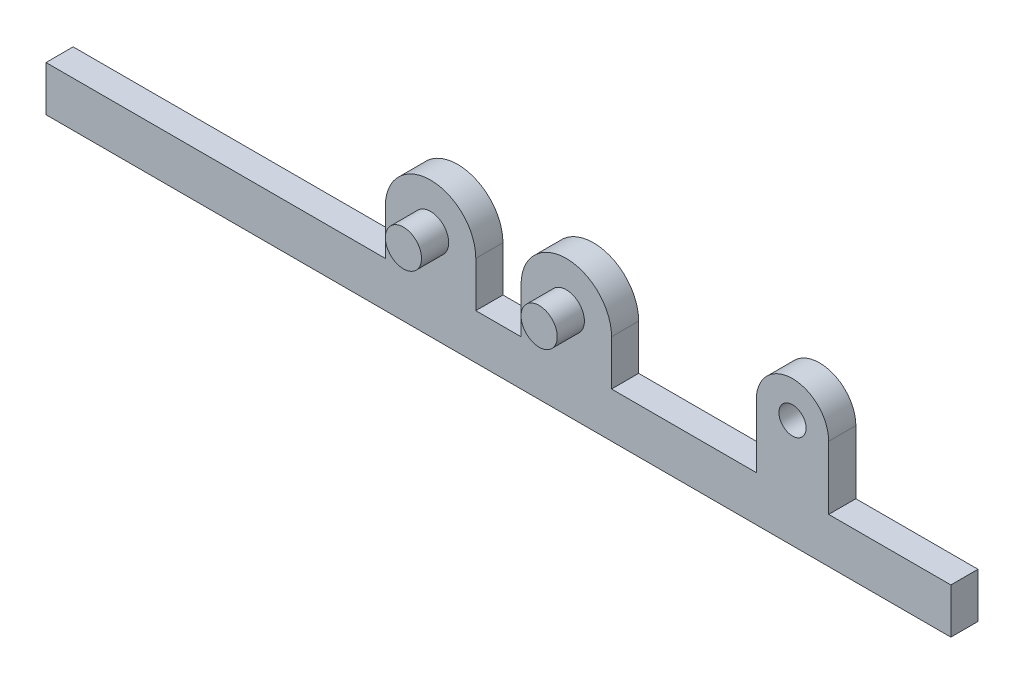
SolidWorks part; units mm, degrees
ref_plane "Face" through (0, 0, 0) normal (0, 0, 1) x (1, 0, 0)
ref_plane "Dessus" through (0, 0, 0) normal (0, 1, 0) x (1, 0, 0)
ref_plane "Droite" through (0, 0, 0) normal (1, 0, 0) x (0, 0, -1)
sketch "Esquisse1" plane through (0, 0, 0) normal (0, 0, 1) x (1, 0, 0)
  line L0 (500, 0) -> (500, -50)
  line L1 (0, 0) -> (375, 0)
  line L2 (0, 0) -> (0, -50)
  line L3 (0, -50) -> (500, -50)
  line L6 (375, 0) -> (375, 50)
  line L8 (475, 0) -> (475, 50)
  line L13 (475, 0) -> (500, 0)
  arc A0 (375, 50) -> (475, 50) centre (425, 50) cw
  dimension "D4" = 50
  dimension "D3" = 50
  dimension "D5" = 75
  dimension "D1" = 500
  dimension "D2" = 50
extrude "Extrusion1" add sketch "Esquisse1" along normal blind 30
sketch "Esquisse2" plane through (0, 0, 30) normal (0, 0, 1) x (1, 0, 0)
  circle A0 centre (425, 50) radius 20
  dimension "D1" = 40
extrude "Extrusion2" add sketch "Esquisse2" along normal blind 30
mirror "Symétrie1"
sketch "Esquisse3" plane through (0, 0, 30) normal (0, 0, 1) x (1, 0, 0)
  line L0 (625, 0) -> (1000, 0) construction
  line L1 (785, 0) -> (865, 0)
  line L2 (785, 0) -> (785, 70)
  line L4 (865, 0) -> (865, 70)
  arc A0 (785, 70) -> (865, 70) centre (825, 70) cw
  circle A2 centre (575, 50) radius 20 construction
  dimension "D3" = 250
  dimension "D1" = 70
  dimension "D2" = 80
extrude "Extrusion3" add sketch "Esquisse3" against normal blind 30
sketch "Esquisse4" plane through (0, 0, 30) normal (0, 0, 1) x (1, 0, 0)
  circle A0 centre (825, 70) radius 15
  dimension "D3" = 30
extrude "Enlèv. mat.-Extru.1" cut sketch "Esquisse4" against normal through all
